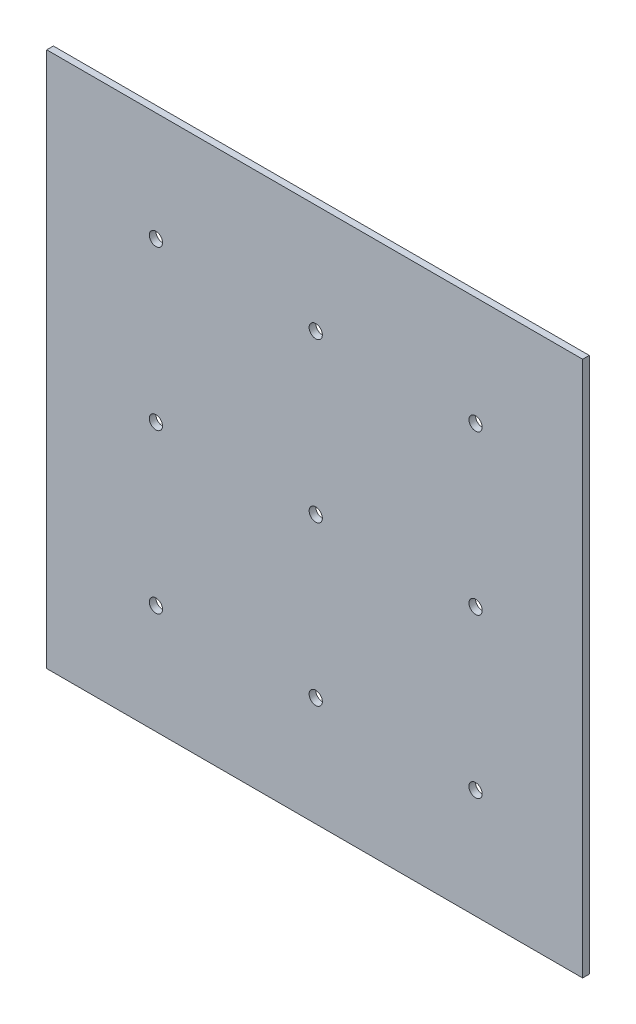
SolidWorks part; units mm, degrees
ref_plane "Front Plane" through (0, 0, 0) normal (0, 0, 1) x (1, 0, 0)
ref_plane "Top Plane" through (0, 0, 0) normal (0, 1, 0) x (1, 0, 0)
ref_plane "Right Plane" through (0, 0, 0) normal (1, 0, 0) x (0, 0, -1)
sketch "Sketch1" plane through (0, 0, 0) normal (0, 0, 1) x (1, 0, 0)
  line L0 (195, 210) -> (-210, 210) construction
  line L1 (-210, 210) -> (-210, -195) construction
  line L2 (-210, -195) -> (195, -195) construction
  line L3 (195, -195) -> (195, 210) construction
  line L4 (195, 210) -> (-210, 210)
  line L5 (-210, 210) -> (-210, -195)
  line L6 (-210, -195) -> (195, -195)
  line L7 (195, -195) -> (195, 210)
extrude "Boss-Extrude1" add sketch "Sketch1" along normal blind 5
sketch "Sketch2" plane through (0, 0, 5) normal (0, 0, 1) x (1, 0, 0)
  line L0 (-127.5, 127.5) -> (114.0793, 127.5)
  line L4 (-127.5, 127.5) -> (-127.5, -112.5)
  line L11 (195, 210) -> (-210, 210) construction
  line L12 (-210, 210) -> (-210, -195) construction
  line L14 (-210, -195) -> (195, -195) construction
  point P2 (114.0793, 130.775)
  point P3 (-128.5312, 127.7424)
  point P4 (0, 0)
  point P5 (-75, 180)
  point P6 (-180, 180)
  point P13 (-129.0164, -117.2982)
  point P15 (-180, 184.339)
  point P16 (-180, 75)
  point P18 (-96.8163, 180)
  point P19 (-180, 180)
  point P20 (-180, 180)
  point P21 (-91.5512, 195)
  point P22 (-75, 180)
  point P23 (-180, 75)
  point P24 (-126.8732, 129.9288)
  dimension "D1" = 82.5
  dimension "D2" = 82.5
  dimension "D3" = 82.5
hole_wizard "Ø10.0 (10) Diameter Hole1" positions "Sketch3" profile "Sketch4" hole size "Ø10.0" standard "DIN"
sketch "Sketch3" plane through (0, 0, 5) normal (0, 0, 1) x (1, 0, 0)
  point P0 (-127.5, 127.5)
  point P4 (0, 0)
sketch "Sketch4" plane through (-127.5, 127.5, 5) normal (1, 0, 0) x (0, -1, 0)
  line L0 (0, 0) -> (0, 5)
  line L1 (0, 5) -> (5, 5)
  line L2 (5, 5) -> (5, 0)
  line L5 (5, 0) -> (0, 0)
  line L11 (0, -6.35) -> (0, 107.95) construction
  dimension "Thru Hole Dia." = 10
  dimension "Thru Hole Depth" = 5
pattern_curve "CrvPattern1" of "Ø10.0 (10) Diameter Hole1" parameters "D1"=3, "D3"=10, "D2"=3, "D4"=10
